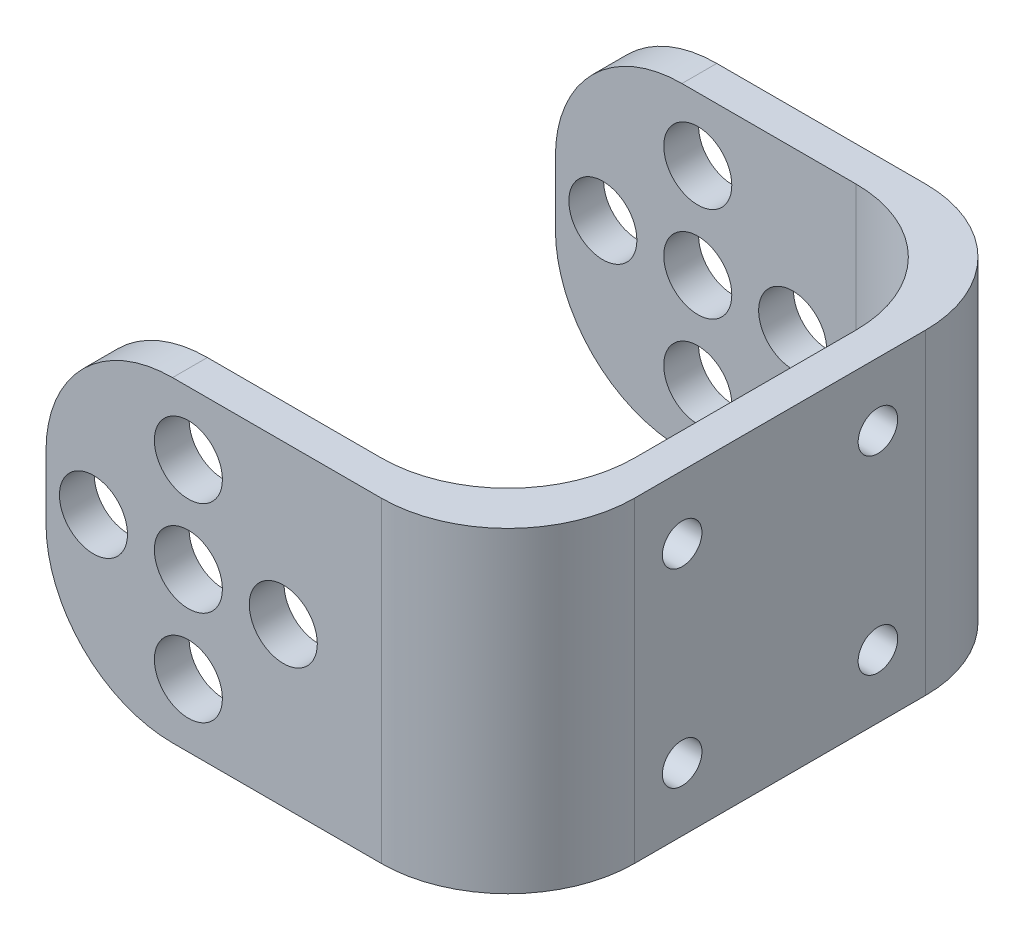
SolidWorks part; units mm, degrees
ref_plane "Front Plane" through (0, 0, 0) normal (0, 0, 1) x (1, 0, 0)
ref_plane "Top Plane" through (0, 0, 0) normal (0, 1, 0) x (1, 0, 0)
ref_plane "Right Plane" through (0, 0, 0) normal (1, 0, 0) x (0, 0, -1)
sketch "Sketch2" plane through (0, 0, 0) normal (0, 1, 0) x (1, 0, 0)
  line L0 (-8.86, 0) -> (11.7, 0) construction
  line L1 (-11.86, 17.2) -> (9.34, 17.2)
  line L2 (-11.86, 17.2) -> (-11.86, 15)
  line L3 (-11.86, 15) -> (7.14, 15)
  line L6 (-11.86, -15) -> (7.14, -15)
  line L7 (-11.86, -17.2) -> (-11.86, -15)
  line L8 (-11.86, -17.2) -> (9.34, -17.2)
  line L9 (17.34, 9.2) -> (17.34, -9.2)
  line L10 (15.14, 7) -> (15.14, -7)
  arc A0 (17.34, -9.2) -> (9.34, -17.2) centre (9.34, -9.2) cw
  arc A1 (9.34, 17.2) -> (17.34, 9.2) centre (9.34, 9.2) cw
  arc A2 (15.14, -7) -> (7.14, -15) centre (7.14, -7) cw
  arc A3 (15.14, 7) -> (7.14, 15) centre (7.14, 7) ccw
  point P13 (17.34, -17.2)
  point P16 (17.34, 17.2)
extrude "Boss-Extrude1" add sketch "Sketch2" along normal mid plane 20 contours L1 A1 L9 A0 L8 L7 L6 A2 L10 A3 L3 L2
sketch "Sketch3" plane through (0, 0, 17.2) normal (0, 0, 1) x (1, 0, 0)
  line L0 (-11.86, 10) -> (-11.86, -10) construction
  line L1 (-11.86, 10) -> (-11.86, 2)
  line L2 (-11.86, -10) -> (9.34, -10) construction
  line L3 (-11.86, 10) -> (9.34, 10) construction
  line L4 (-11.86, -10) -> (-3.86, -10)
  line L5 (-11.86, 10) -> (-3.86, 10)
  line L6 (-11.86, 0) -> (9.34, 0) construction
  line L7 (-11.86, 0) -> (9.34, 0) construction
  line L8 (-11.86, -2) -> (-11.86, -10)
  line L10 (9.34, 10) -> (9.34, -10) construction
  arc A0 (-3.86, 10) -> (-11.86, 2) centre (-3.86, 2) ccw
  arc A1 (-3.86, -10) -> (-11.86, -2) centre (-3.86, -2) cw
  circle A2 centre (-2.86, 0) radius 2.15
  circle A3 centre (-2.86, -6) radius 2.15
  circle A4 centre (-2.86, 6) radius 2.15
  circle A5 centre (3.14, 0) radius 2.15
  circle A6 centre (-8.86, 0) radius 2.15
  dimension "D1" = 16
  dimension "D2" = 4.3
  dimension "D3" = 3
  dimension "D4" = 6
  dimension "D5" = 6
  dimension "D6" = 6.2
  dimension "D7" = 6
  dimension "D8" = 6
extrude "Cut-Extrude2" cut sketch "Sketch3" against normal through all
sketch "Sketch5" plane through (17.34, 0, 0) normal (1, 0, 0) x (0, 0, -1)
  line L0 (9.2, 10) -> (-9.2, 10) construction
  line L1 (-9.2, 10) -> (-9.2, -10) construction
  line L2 (9.2, 10) -> (9.2, -10) construction
  circle A0 centre (-6.187, 6) radius 1.25
  circle A1 centre (6.187, 6) radius 1.25
  circle A2 centre (-6.187, -6) radius 1.25
  circle A3 centre (6.187, -6) radius 1.25
extrude "Cut-Extrude3" cut sketch "Sketch5" against normal through all
ref_plane "Plane1" through (0, 0, 0) normal (0, 0, -1) x (-1, 0, 0)
equation "\"D2@Sketch2\"=\"D1@Sketch2\""
equation "\"D4@Sketch5\"=\"D3@Sketch5\""
